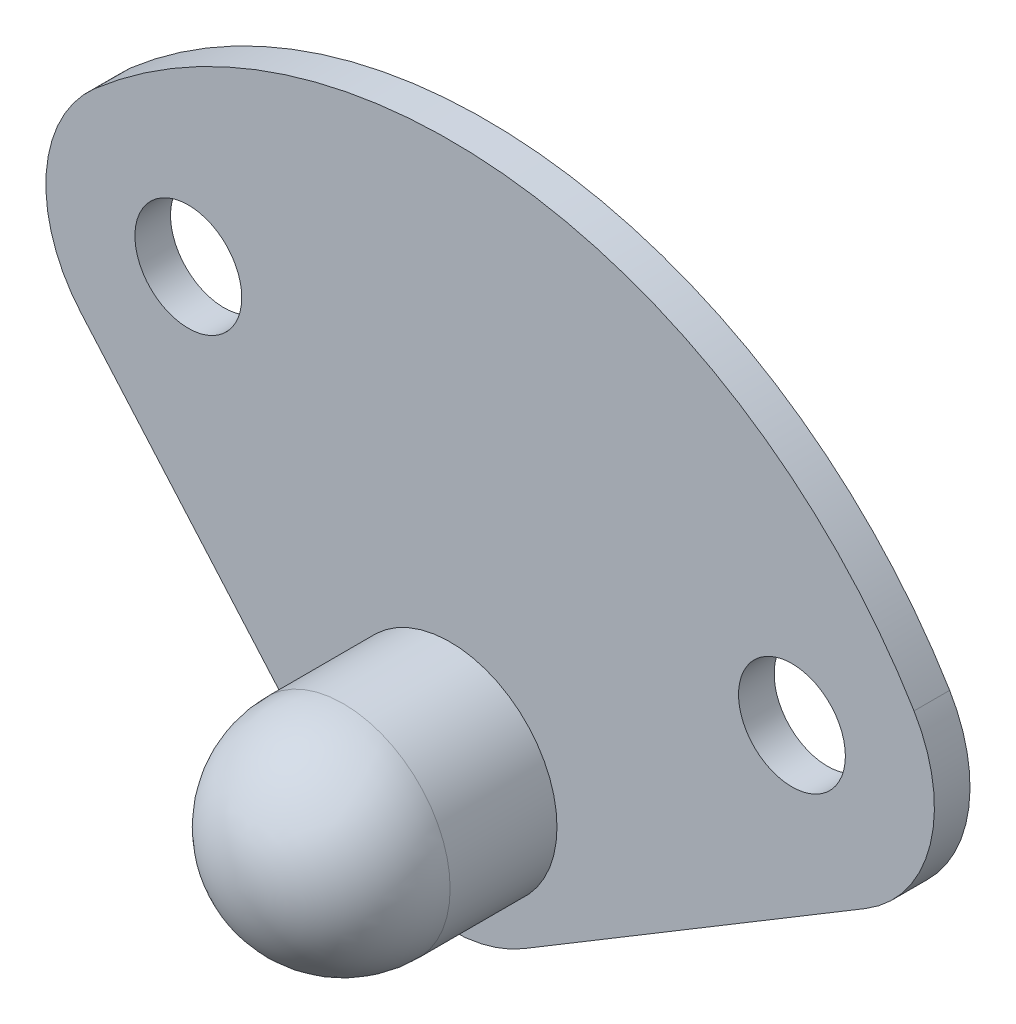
SolidWorks part; units mm, degrees
ref_plane "Plan de face" through (0, 0, 0) normal (0, 0, 1) x (1, 0, 0)
ref_plane "Plan de dessus" through (0, 0, 0) normal (0, 1, 0) x (1, 0, 0)
ref_plane "Plan de droite" through (0, 0, 0) normal (1, 0, 0) x (0, 0, -1)
sketch "Esquisse1" plane through (0, 0, 0) normal (0, 0, 1) x (1, 0, 0)
  line L0 (-30.1764, -26.2562) -> (-103.6936, 58.2377)
  line L2 (116.5936, 23.4509) -> (20.6172, -34.2773)
  circle A0 centre (0, 0) radius 30
  arc A1 (20.6172, -34.2773) -> (-30.1764, -26.2562) centre (0, 0) cw
  circle A2 centre (95.9764, 57.7281) radius 15
  circle A3 centre (-73.5172, 84.4939) radius 15
  arc A4 (130.2536, 78.3453) -> (116.5936, 23.4509) centre (95.9764, 57.7281) cw
  arc A5 (-103.6936, 58.2377) -> (-99.7734, 114.6703) centre (-73.5172, 84.4939) cw
  arc A6 (130.2536, 78.3453) -> (-99.7734, 114.6703) centre (0, 0) ccw
  dimension "D1" = 60
  dimension "D2" = 40
  dimension "D3" = 40
  dimension "D4" = 30
extrude "Boss.-Extru.1" add sketch "Esquisse1" along normal blind 10
sketch "Esquisse2" plane through (0, 0, 0) normal (0, 0, 1) x (1, 0, 0)
  circle A0 centre (0, 0) radius 30 construction
  circle A1 centre (0, 0) radius 30
  circle A2 centre (0, 0) radius 27
  dimension "D1" = 3
extrude "Boss.-Extru.2" add sketch "Esquisse2" along normal blind 40 and the other way blind 30
sketch "Esquisse3" plane through (0, 0, 0) normal (1, 0, 0) x (0, 0, -1)
  line L0 (0, 0) -> (-92.0402, 0) construction
  line L1 (-40, 30) -> (-40, 0)
  line L3 (-40, 30) -> (-40, -30) construction
  line L4 (-40, 0) -> (-70, 0)
  arc A0 (-40, 30) -> (-70, 0) centre (-40, 0) ccw
revolve "Révolution1" add sketch "Esquisse3" angle 360 about L0
